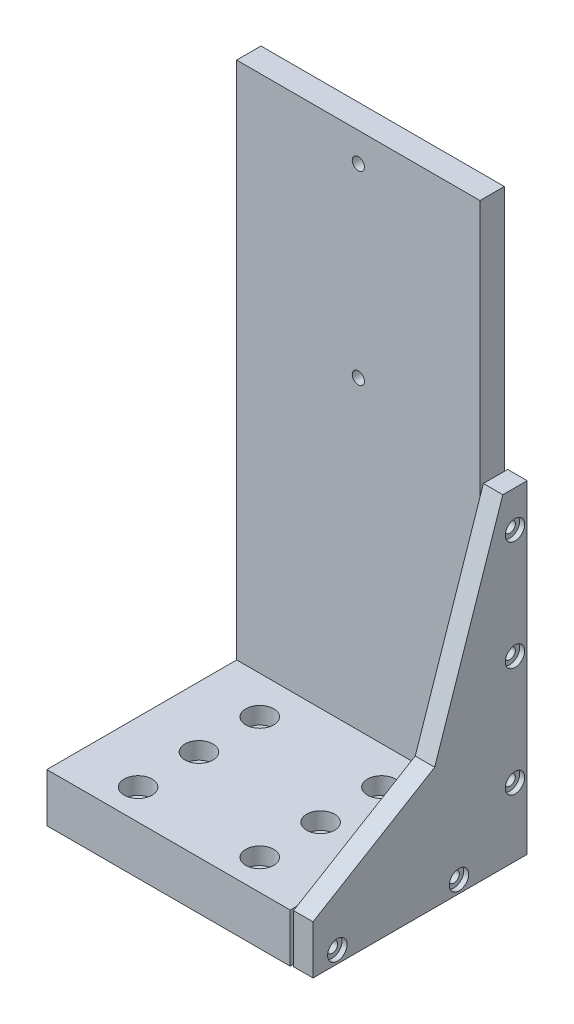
SolidWorks part; units mm, degrees
other "NONE"
ref_plane "Plan de face" through (0, 0, 0) normal (0, 0, 1) x (1, 0, 0)
ref_plane "Plan de dessus" through (0, 0, 0) normal (0, 1, 0) x (1, 0, 0)
ref_plane "Plan de droite" through (0, 0, 0) normal (1, 0, 0) x (0, 0, -1)
imported_body "Importée1"
imported_body "Importée2"
imported_body "Importée3"
mirror "Symétrie1" about plane through (0, 0, 0) normal (1, 0, 0)
